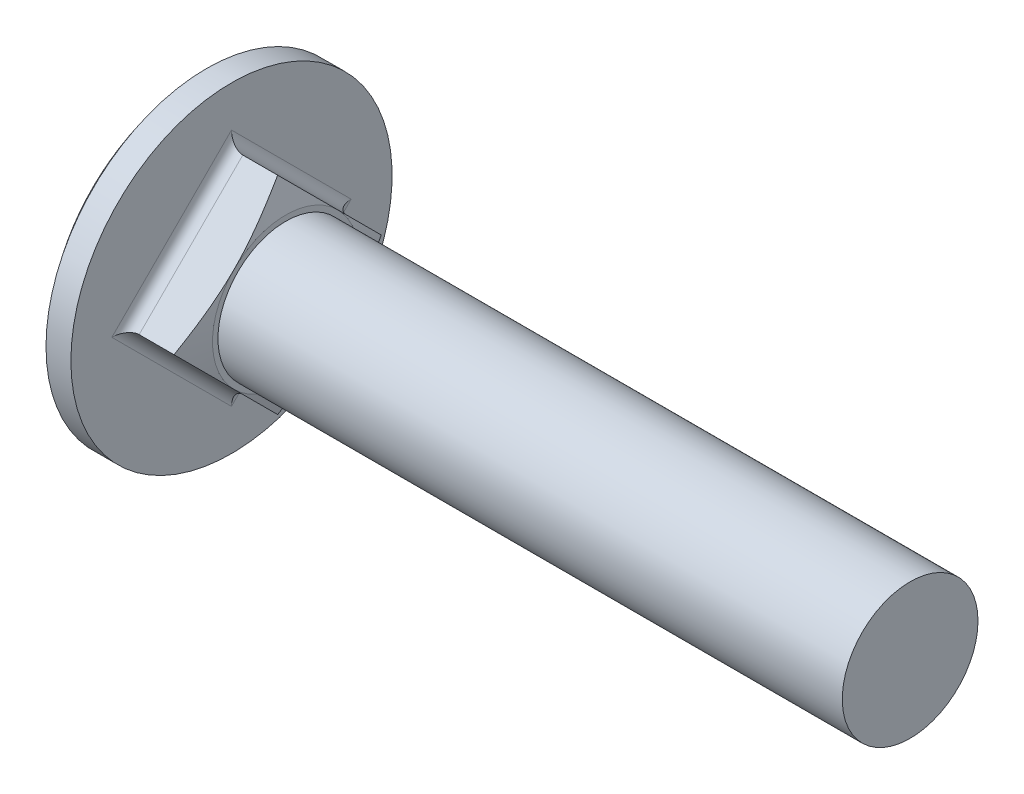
SolidWorks part; units mm, degrees
ref_plane "Front" through (0, 0, 0) normal (0, 0, 1) x (1, 0, 0)
ref_plane "Top" through (0, 0, 0) normal (0, 1, 0) x (1, 0, 0)
ref_plane "Right" through (0, 0, 0) normal (1, 0, 0) x (0, 0, -1)
sketch "Sketch2" plane through (0, 0, 0) normal (0, 0, 1) x (1, 0, 0)
  line L0 (-6.2668, 0) -> (14.9447, 0) construction
  line L1 (3.6, 0) -> (3.6, 7.1)
  line L3 (3.6, 7.1) -> (2.5, 7.1)
  line L4 (0, 0) -> (3.6, 0)
  arc A0 (2.5, 7.1) -> (0, 0) centre (11.332, 0) ccw
  dimension "k" = 3.6
  dimension "c" = 1.1
  dimension "dk" = 14.2
revolve "BaseHead" add sketch "Sketch2" angle 360 about L0
sketch "Sketch3" plane through (3.6, 0, 0) normal (1, 0, 0) x (0, 0, -1)
  line L1 (4.5821, 0) -> (0, 4.5821)
  line L2 (0, 4.5821) -> (-4.5821, 0)
  line L3 (-4.5821, 0) -> (0, -4.5821)
  line L4 (0, -4.5821) -> (4.5821, 0)
  circle A1 centre (0, 0) radius 3.24 construction
  dimension "V" = 6.48
extrude "Neck" add sketch "Sketch3" along normal blind 2.4
sketch "Sketch4" plane through (0, 0, 0) normal (0, 0, 1) x (1, 0, 0)
  line L0 (2.9848, 0) -> (9.124, 0) construction
  line L2 (6, 4.5821) -> (6, 3.24)
  line L4 (6, 3.24) -> (5.6404, 4.5821)
  line L6 (5.6404, 4.5821) -> (6, 4.5821)
  line L7 (-6.2668, 0) -> (14.9447, 0) construction
  dimension "D1" = 15
  dimension "D2" = 6.48
revolve "Cut-Extrude1" cut sketch "Sketch4" angle 360 about L0
sketch "Sketch5" plane through (3.6, 0, 0) normal (1, 0, 0) x (0, 0, -1)
  circle A0 centre (0, 0) radius 3
  dimension "d" = 6
extrude "BaseBody" add sketch "Sketch5" along normal blind 30
fillet "Fillet1" radius 0.5 4 edges at (3.6, 2.291, -2.291) (3.6, -2.291, -2.291) (3.6, -2.291, 2.291) (3.6, 2.291, 2.291)
sketch "Sketch7" plane through (0, 0, 0) normal (0, 0, 1) x (1, 0, 0)
  line L0 (33.35, 3.2) -> (33.85, 3.2)
  line L1 (33.85, 3.2) -> (33.85, 3)
  line L2 (33.85, 3) -> (33.6, 2.567)
  line L3 (33.35, 3) -> (33.6, 2.567)
  line L4 (33.35, 3.2) -> (33.35, 3)
  line L5 (35.9661, 0) -> (0, 0) construction
  line L6 (33.35, 3) -> (33.85, 3) construction
  line L7 (33.6, 3) -> (33.6, 2.567) construction
  line L8 (33.6, -3) -> (33.6, 3) construction
  line L10 (33.6, 3) -> (6, 3) construction
  point P5 (33.6, 3.2)
  dimension "D1" = 0.2
  dimension "D2" = 0.5
revolve "Cut-Revolve10" [suppressed] cut sketch "Sketch7" angle 360 about L5
pattern_linear "LPattern10" [suppressed] count 30 spacing 0.6 along (1, 0, 0)
equation "\"D2@Sketch4\" = \"V@Sketch3\""
equation "\"D2@Sketch7\" =( \"d@Sketch5\" - \"dn@ThreadCosmetic1\") / 2"
equation "\"D3@LPattern10\" = \"D2@Sketch7\" * 1.2"
equation "\"D1@LPattern10\" = \"b@ThreadCosmetic1\" / \"D3@LPattern10\""
